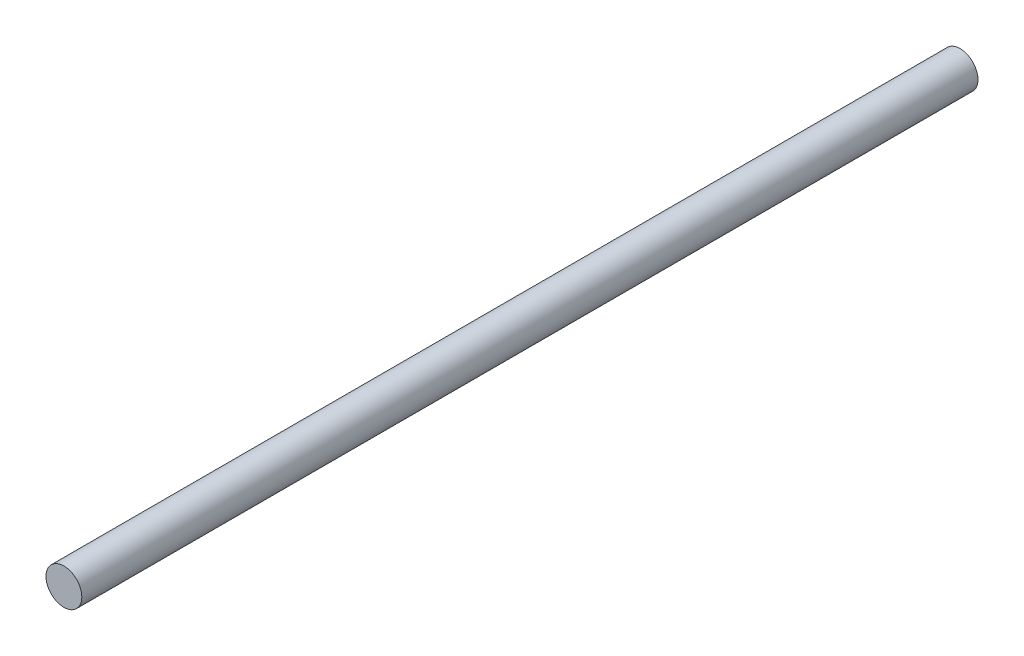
SolidWorks part; units mm, degrees
ref_plane "Front Plane" through (0, 0, 0) normal (0, 0, 1) x (1, 0, 0)
ref_plane "Top Plane" through (0, 0, 0) normal (0, 1, 0) x (1, 0, 0)
ref_plane "Right Plane" through (0, 0, 0) normal (1, 0, 0) x (0, 0, -1)
sketch "Sketch1" plane through (0, 0, 0) normal (0, 1, 0) x (1, 0, 0)
  line L0 (-21.5819, -11.0541) -> (-21.5819, -42.8041)
  line L1 (-20.9469, -42.8041) -> (-20.9469, -11.0541)
  line L2 (-20.9469, -11.0541) -> (-21.5819, -11.0541)
  line L3 (-21.5819, -42.8041) -> (-20.9469, -42.8041)
  dimension "D1" = 31.75
  dimension "D2" = 0.635
revolve "Revolve1" add sketch "Sketch1" angle 360 about L1
